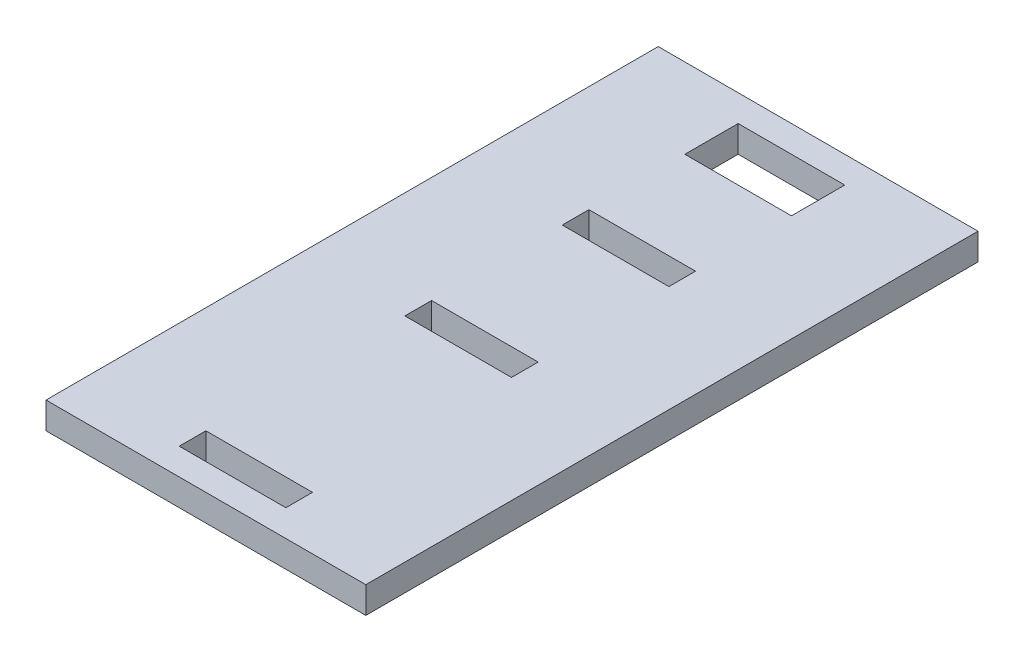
SolidWorks part; units mm, degrees
ref_plane "Front Plane" through (0, 0, 0) normal (0, 0, 1) x (1, 0, 0)
ref_plane "Top Plane" through (0, 0, 0) normal (0, 1, 0) x (1, 0, 0)
ref_plane "Right Plane" through (0, 0, 0) normal (1, 0, 0) x (0, 0, -1)
sketch "Sketch1" plane through (0, 0, 0) normal (0, 1, 0) x (1, 0, 0)
  line L0 (19.9999, 104.8614) -> (0, 104.8614) construction
  line L1 (0, 0) -> (59.9999, 0)
  line L2 (0, 0) -> (0, 114.8614)
  line L3 (0, 114.8614) -> (59.9999, 114.8614)
  line L4 (59.9999, 0) -> (59.9999, 114.8614)
  line L5 (19.9999, 109.8614) -> (39.9999, 109.8614)
  line L6 (19.9999, 109.8614) -> (19.9999, 99.8614)
  line L7 (19.9999, 99.8614) -> (39.9999, 99.8614)
  line L8 (39.9999, 109.8614) -> (39.9999, 99.8614)
  line L9 (19.9999, 5) -> (39.9999, 5)
  line L10 (19.9999, 5) -> (19.9999, 10)
  line L11 (19.9999, 10) -> (39.9999, 10)
  line L12 (39.9999, 5) -> (39.9999, 10)
  line L13 (19.9999, 47.338) -> (39.9999, 47.338)
  line L14 (19.9999, 47.338) -> (19.9999, 52.338)
  line L15 (19.9999, 52.338) -> (39.9999, 52.338)
  line L16 (39.9999, 47.338) -> (39.9999, 52.338)
  line L17 (19.9999, 76.8642) -> (39.9999, 76.8642)
  line L18 (19.9999, 76.8642) -> (19.9999, 81.8642)
  line L19 (19.9999, 81.8642) -> (39.9999, 81.8642)
  line L20 (39.9999, 76.8642) -> (39.9999, 81.8642)
  line L21 (39.9999, 104.8614) -> (59.9999, 104.8614) construction
  point P25 (29.9999, 5)
  dimension "D1" = 114.8614
  dimension "D2" = 59.9999
  dimension "D3" = 20
  dimension "D4" = 5
  dimension "D5" = 10
  dimension "D6" = 5
  dimension "D7" = 5
  dimension "D8" = 37.338
  dimension "D9" = 24.5262
extrude "Boss-Extrude1" add sketch "Sketch1" along normal blind 5
